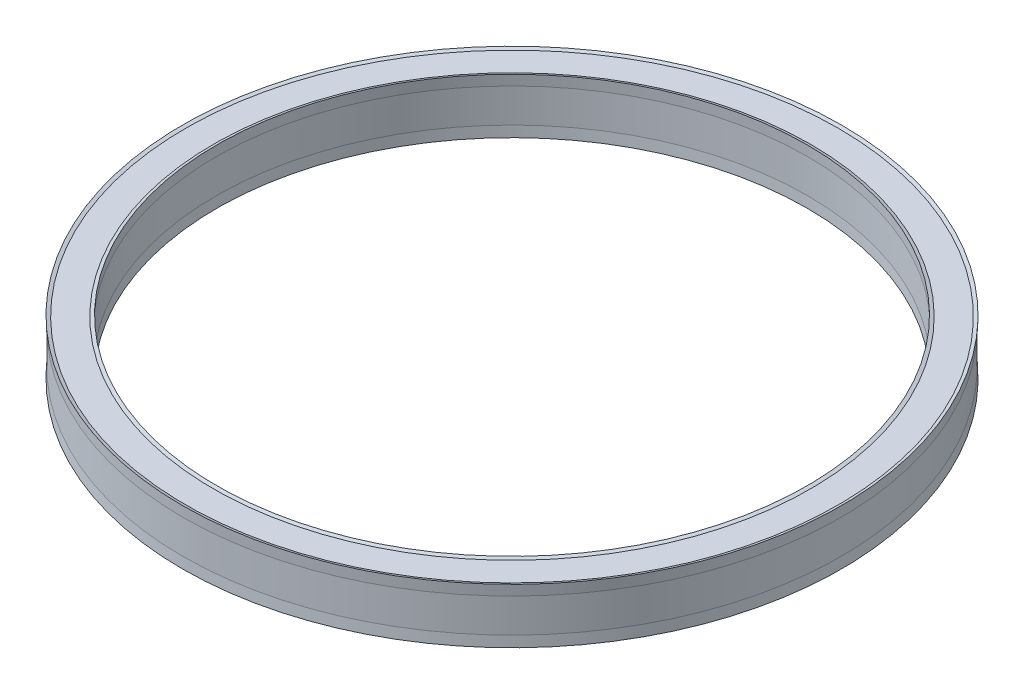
SolidWorks part; units mm, degrees
ref_plane "Front Plane" through (0, 0, 0) normal (0, 0, 1) x (1, 0, 0)
ref_plane "Top Plane" through (0, 0, 0) normal (0, 1, 0) x (1, 0, 0)
ref_plane "Right Plane" through (0, 0, 0) normal (1, 0, 0) x (0, 0, -1)
sketch "Sketch1" plane through (0, 0, 0) normal (0, 0, 1) x (1, 0, 0)
  line L0 (34.1313, 6.35) -> (34.1948, 5.1308)
  line L1 (34.1948, 5.1308) -> (34.1947, 1.2192)
  line L2 (34.1947, 1.2192) -> (34.1313, 0)
  line L3 (34.5123, 0.127) -> (34.1313, 0)
  line L5 (34.5123, 0.127) -> (37.719, 0.127)
  line L6 (34.1313, 6.35) -> (34.5123, 6.223)
  line L7 (34.5123, 6.223) -> (37.719, 6.223)
  line L8 (36.1156, 6.223) -> (36.1156, 0.127) construction
  line L9 (0, 0) -> (0, 12.3922) construction
  line L10 (38.1, 6.35) -> (37.719, 6.223)
  line L11 (38.1, 0) -> (37.719, 0.127)
  line L13 (38.0365, 1.2192) -> (38.1, 0)
  line L14 (38.0365, 5.1308) -> (38.0365, 1.2192)
  line L15 (38.1, 6.35) -> (38.0365, 5.1308)
  line L16 (34.1948, 3.175) -> (45.4511, 3.175) construction
  dimension "D1" = 76.2
  dimension "D2" = 0.0635
  dimension "D3" = 6.35
  dimension "D4" = 1.2192
  dimension "D5" = 0.127
  dimension "D6" = 0.381
  dimension "D7" = 3.9688
revolve "Revolve1" add sketch "Sketch1" angle 360 about L9
